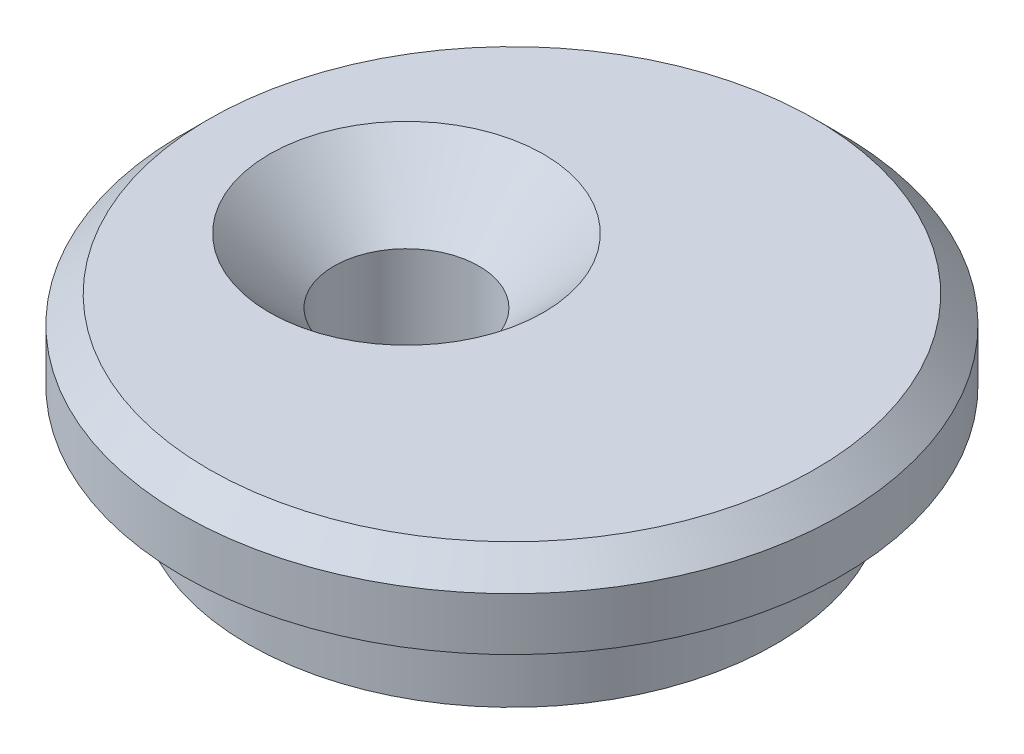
SolidWorks part; units mm, degrees
ref_plane "Front Plane" through (0, 0, 0) normal (0, 0, 1) x (1, 0, 0)
ref_plane "Top Plane" through (0, 0, 0) normal (0, 1, 0) x (1, 0, 0)
ref_plane "Right Plane" through (0, 0, 0) normal (1, 0, 0) x (0, 0, -1)
sketch "Sketch1" plane through (0, 0, 0) normal (0, 1, 0) x (1, 0, 0)
  circle A0 centre (0, 0) radius 10
  dimension "D1" = 20
extrude "Extrude1" add sketch "Sketch1" along normal blind 3.5
sketch "Sketch2" plane through (0, 3.5, 0) normal (0, 1, 0) x (1, 0, 0)
  circle A0 centre (0, 0) radius 12.5
  dimension "D1" = 25
extrude "Extrude2" add sketch "Sketch2" along normal blind 3
chamfer "Chamfer1" distance 1 angle 45 1 edges at (0, 6.5, 12.5)
sketch "Sketch3" plane through (0, 6.5, 0) normal (0, 1, 0) x (1, 0, 0)
  line L0 (0, 0) -> (-11.5, 0) construction
  circle A0 centre (0, 0) radius 11.5 construction
  point P5 (-4, 0)
  dimension "D1" = 4
hole_wizard "CSK for M5 Countersunk Flat Head Screw1" positions "3DSketch1" profile "Sketch4" countersink size "M5" standard "ISO"
sketch3d "3DSketch1"
  point P0 (-4, 6.5, 0)
sketch "Sketch4" plane through (-4, 6.5, 0) normal (1, 0, 0) x (0, 0, 1)
  line L0 (0, 0) -> (0, 6.5)
  line L1 (0, 6.5) -> (2.75, 6.5)
  line L2 (2.75, 6.5) -> (2.75, 2.45)
  line L3 (2.75, 2.45) -> (5.2, 0)
  line L5 (5.2, 0) -> (0, 0)
  line L6 (-2.75, 2.45) -> (-5.2, 0) construction
  line L11 (0, -6.35) -> (0, 107.95) construction
  dimension "Thru Hole Dia." = 5.5
  dimension "Thru Hole Depth" = 6.5
  dimension "Near C'Sink Dia." = 10.4
  dimension "Near C'Sink Angle" = 90
